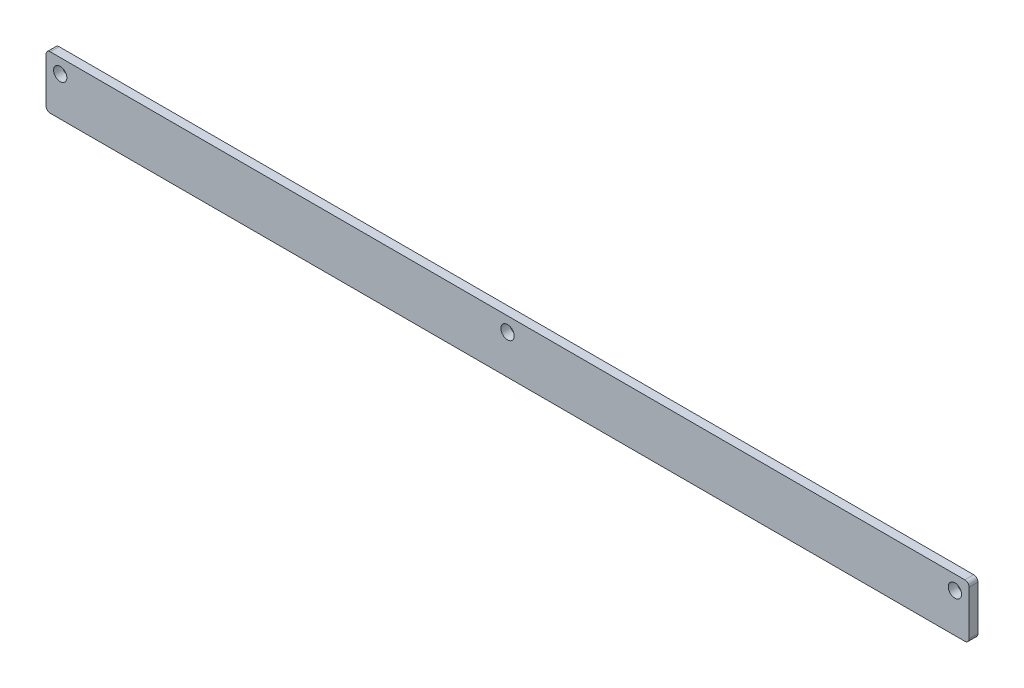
SolidWorks part; units mm, degrees
ref_plane "Front" through (0, 0, 0) normal (0, 0, 1) x (1, 0, 0)
ref_plane "Top" through (0, 0, 0) normal (0, 1, 0) x (1, 0, 0)
ref_plane "Right" through (0, 0, 0) normal (1, 0, 0) x (0, 0, -1)
sketch "Sketch1" plane through (0, 0, 0) normal (0, 0, 1) x (1, 0, 0)
  line L0 (-965.2, 180.6575) -> (-625.7925, 180.6575) construction
  line L1 (-624.7765, 179.3875) -> (-951.9285, 179.3875)
  line L2 (-623.2525, 180.9115) -> (-623.2525, 196.9135)
  line L3 (-624.7765, 198.4375) -> (-951.9285, 198.4375)
  line L4 (-953.4525, 180.9115) -> (-953.4525, 196.9135)
  line L5 (-621.9825, 196.9135) -> (-621.9825, 152.019) construction
  arc A0 (-951.9285, 179.3875) -> (-953.4525, 180.9115) centre (-951.9285, 180.9115) cw
  arc A1 (-623.2525, 196.9135) -> (-624.7765, 198.4375) centre (-624.7765, 196.9135) ccw
  arc A2 (-951.9285, 198.4375) -> (-953.4525, 196.9135) centre (-951.9285, 196.9135) ccw
  arc A3 (-624.7765, 179.3875) -> (-623.2525, 180.9115) centre (-624.7765, 180.9115) ccw
  point P12 (-623.2525, 198.4375)
  point P15 (-953.4525, 198.4375)
  dimension "D5" = 1.524
  dimension "D1" = 1.27
  dimension "D2" = 1.27
  dimension "D3" = 19.05
  dimension "D4" = 330.2
extrude "Boss-Extrude1" add sketch "Sketch1" along normal blind 3.175 separate body
hole_wizard "Hole1" positions "Point_Sketch" profile "Profil_Sketch" hole size "Ø0.15" standard "ISO"
sketch "Point_Sketch" plane through (-631.9868, 203.9586, 3.175) normal (0, 0, -1) x (1, 0, 0)
  point P0 (3.6543, 10.6011)
  point P2 (-316.3857, 10.6011)
  point P4 (-156.3657, 10.6011)
sketch "Profil_Sketch" plane through (-628.3325, 193.3575, 3.175) normal (1, 0, 0) x (0, -1, 0)
  line L0 (0, 0) -> (0, 3.175)
  line L1 (0, 3.175) -> (2.3812, 3.175)
  line L2 (2.3812, 3.175) -> (2.3813, 0)
  line L5 (2.3813, 0) -> (0, 0)
  line L11 (0, -6.35) -> (0, 107.95) construction
  dimension "Diameter" = 4.7625
  dimension "Thru Hole Depth" = 3.175
other "usin_DL090_8-32x.375-BHCS<1>"
